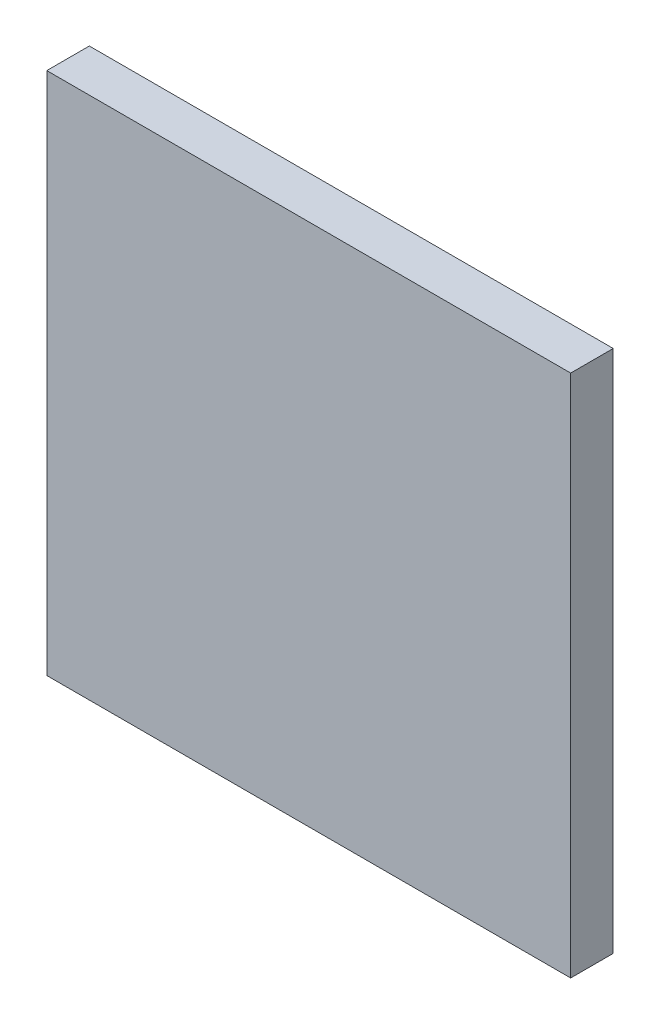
SolidWorks part; units mm, degrees
ref_plane "Plan de face" through (0, 0, 0) normal (0, 0, 1) x (1, 0, 0)
ref_plane "Plan de dessus" through (0, 0, 0) normal (0, 1, 0) x (1, 0, 0)
ref_plane "Plan de droite" through (0, 0, 0) normal (1, 0, 0) x (0, 0, -1)
sketch "Esquisse1" plane through (0, 0, 0) normal (0, 0, 1) x (1, 0, 0)
  line L1 (-4, 4) -> (4, 4)
  line L2 (-4, 4) -> (-4, -4)
  line L3 (-4, -4) -> (4, -4)
  line L4 (4, 4) -> (4, -4)
  line L5 (-4, 4) -> (4, -4) construction
  line L6 (-4, -4) -> (4, 4) construction
  point P0 (0, 0)
  dimension "D1" = 8
extrude "Boss.-Extru.1" add sketch "Esquisse1" along normal blind 0.65
